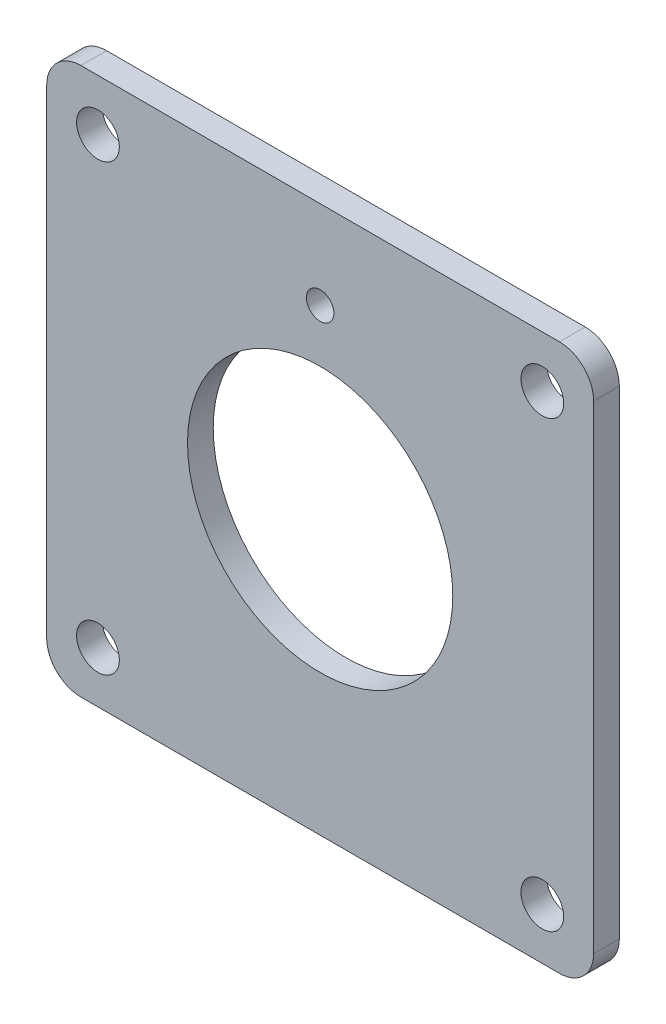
SolidWorks part; units mm, degrees
ref_plane "Front Plane" through (0, 0, 0) normal (0, 0, 1) x (1, 0, 0)
ref_plane "Top Plane" through (0, 0, 0) normal (0, 1, 0) x (1, 0, 0)
ref_plane "Right Plane" through (0, 0, 0) normal (1, 0, 0) x (0, 0, -1)
sketch "Sketch1" plane through (0, 0, 0) normal (0, 0, 1) x (1, 0, 0)
  line L10 (-50.8, 44.45) -> (-50.8, -44.45)
  line L11 (-44.45, -50.8) -> (44.45, -50.8)
  line L12 (50.8, -44.45) -> (50.8, 44.45)
  line L13 (44.45, 50.8) -> (-44.45, 50.8)
  arc A9 (-50.8, -44.45) -> (-44.45, -50.8) centre (-44.45, -44.45) ccw
  arc A10 (44.45, -50.8) -> (50.8, -44.45) centre (44.45, -44.45) ccw
  arc A11 (50.8, 44.45) -> (44.45, 50.8) centre (44.45, 44.45) ccw
  arc A12 (-44.45, 50.8) -> (-50.8, 44.45) centre (-44.45, 44.45) ccw
extrude "Boss-Extrude1" add sketch "Sketch1" along normal blind 4.7752
sketch "Sketch3" plane through (0, 0, 0) normal (0, 0, 1) x (1, 0, 0)
  circle A0 centre (0, 0) radius 24.638
  dimension "D1" = 49.276
extrude "Cut-Extrude1" cut sketch "Sketch3" along normal through all
hole_wizard "5/16 (0.3125) Diameter Hole1" positions "Sketch4" profile "Sketch5" hole size "5/16" standard "ANSI Inch"
sketch "Sketch4" plane through (0, 0, 0) normal (0, 0, 1) x (1, 0, 0)
  point P0 (-41.275, 41.275)
  point P3 (41.275, 41.275)
  point P6 (41.275, -41.275)
  point P9 (-41.275, -41.275)
sketch "Sketch5" plane through (-41.275, 41.275, 0) normal (1, 0, 0) x (0, 1, 0)
  line L0 (0, 0) -> (0, 4.7752)
  line L1 (0, 4.7752) -> (3.9687, 4.7752)
  line L2 (3.9687, 4.7752) -> (3.9687, 0)
  line L5 (3.9687, 0) -> (0, 0)
  line L11 (0, -6.35) -> (0, 107.95) construction
  dimension "Thru Hole Dia." = 7.9375
  dimension "Thru Hole Depth" = 4.7752
hole_wizard "Tap Drill for 3/8-16 Tap1" positions "Sketch6" profile "Sketch7" hole size "3/8-16" standard "ANSI Inch"
sketch "Sketch6" plane through (0, 0, 0) normal (0, 0, -1) x (-1, 0, 0)
  point P0 (0.0153, 37.4065)
sketch "Sketch7" plane through (-0.0153, 37.4065, 0) normal (1, 0, 0) x (0, 1, 0)
  line L0 (0, 0) -> (0, 4.7752)
  line L1 (0, 4.7752) -> (3.9687, 4.7752)
  line L2 (3.9687, 4.7752) -> (3.9687, 0)
  line L5 (3.9687, 0) -> (0, 0)
  line L11 (0, -6.35) -> (0, 107.95) construction
  dimension "Thru Hole Dia." = 7.9375
  dimension "Thru Hole Depth" = 4.7752
thread "Thread1" pitch 1.5875 start angle 0, offset 0, length 0, pitch 1.5875, diameter 7.9375
ref_plane "Plane1" through (-3.984, 37.4065, 4.7752) normal (0, -1, 0) x (-1, 0, 0)
sketch "Thread Profile1" plane through (-3.984, 37.4065, 4.7752) normal (0, -1, 0) x (-1, 0, 0)
  line L0 (0, 0) -> (0, 1.5875) construction
  line L1 (0, 0) -> (0.8593, 0.4961)
  line L2 (0.8593, 0.4961) -> (0.8593, 0.6945)
  line L3 (0.8593, 0.6945) -> (0, 1.1906)
  line L4 (0.8593, 0.5953) -> (0, 0.5953) construction
  line L11 (0, 0) -> (0, 1.1906)
  point P2 (0, 0)
  dimension "Pitch" = 1.5875
  dimension "Profile_Angle" = 60
  dimension "Profile_Land" = 0.1984
  dimension "Profile_Height" = 0.8593
hole_wizard "Tap Drill for 1/4-20 Tap1" positions "Sketch8" profile "Sketch9" hole size "1/4-20" standard "ANSI Inch"
sketch "Sketch8" plane through (0, 0, 0) normal (0, 0, -1) x (-1, 0, 0)
  point P0 (0, 33.0235)
sketch "Sketch9" plane through (0, 33.0235, 0) normal (1, 0, 0) x (0, 1, 0)
  line L0 (0, 0) -> (0, 4.7752)
  line L1 (0, 4.7752) -> (2.5527, 4.7752)
  line L2 (2.5527, 4.7752) -> (2.5527, 0)
  line L5 (2.5527, 0) -> (0, 0)
  line L11 (0, -6.35) -> (0, 107.95) construction
  dimension "Thru Hole Dia." = 5.1054
  dimension "Thru Hole Depth" = 4.7752
hole_wizard "Tap Drill for 1/4-20 Tap2" positions "Sketch13" profile "Sketch14" hole size "1/4-20" standard "ANSI Inch"
sketch "Sketch13" plane through (0, 0, 0) normal (0, 0, -1) x (-1, 0, 0)
  line L0 (-50.8, -44.45) -> (-50.8, 44.45) construction
  line L2 (-44.45, 50.8) -> (44.45, 50.8) construction
  point P0 (0, 34.417)
  dimension "D1" = 16.383
  dimension "D2" = 50.8
sketch "Sketch14" plane through (0, 34.417, 0) normal (1, 0, 0) x (0, 1, 0)
  line L0 (0, 0) -> (0, 4.7752)
  line L1 (0, 4.7752) -> (2.5527, 4.7752)
  line L2 (2.5527, 4.7752) -> (2.5527, 0)
  line L5 (2.5527, 0) -> (0, 0)
  line L11 (0, -6.35) -> (0, 107.95) construction
  dimension "Thru Hole Dia." = 5.1054
  dimension "Thru Hole Depth" = 4.7752
